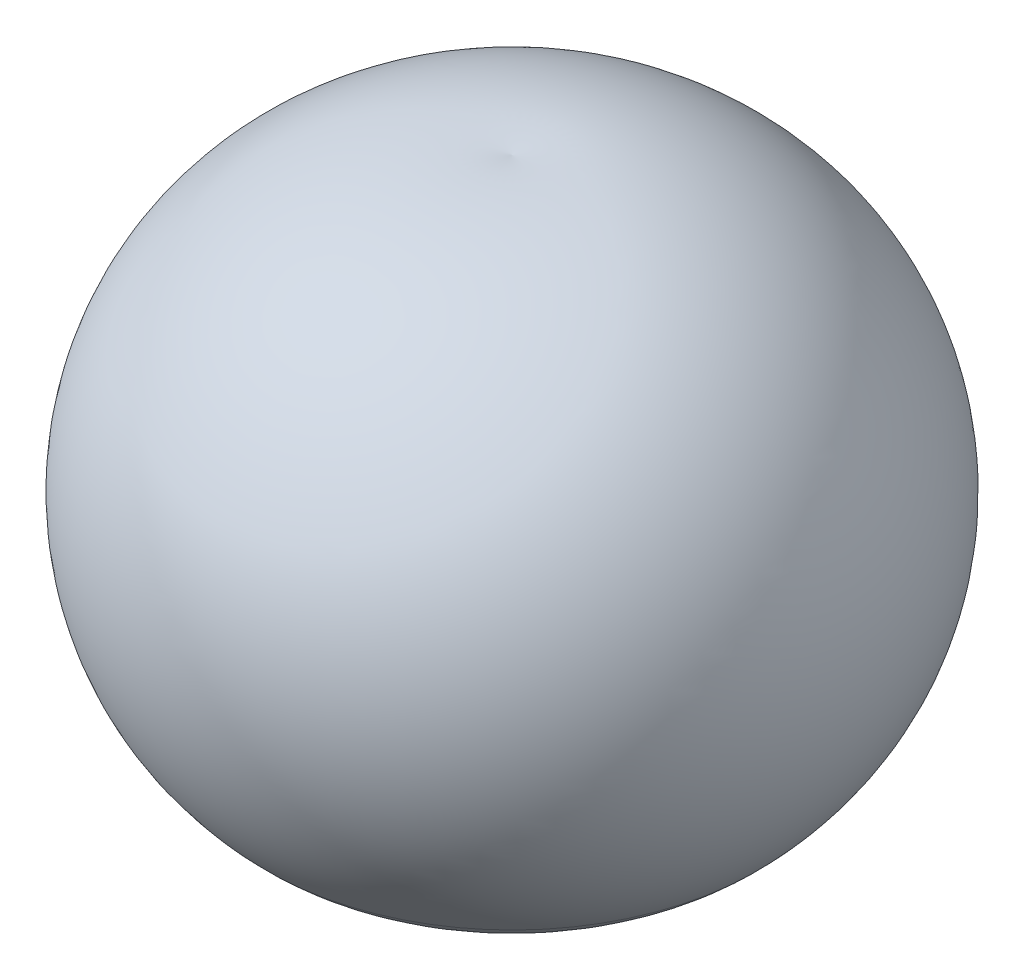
SolidWorks part; units mm, degrees
ref_plane "前视基准面" through (0, 0, 0) normal (0, 0, 1) x (1, 0, 0)
ref_plane "上视基准面" through (0, 0, 0) normal (0, 1, 0) x (1, 0, 0)
ref_plane "右视基准面" through (0, 0, 0) normal (1, 0, 0) x (0, 0, -1)
sketch "草图2" plane through (0, 0, 0) normal (1, 0, 0) x (0, 0, -1)
  line L0 (0, 0) -> (0, 550) construction
  line L1 (0, 550) -> (-230, 550) construction
  line L2 (-230, 550) -> (-230, 1400) construction
  line L3 (-230, 550) -> (-831.0408, -51.0408) construction
  line L4 (-831.0408, -51.0408) -> (-951.2489, -171.2489) construction
  line L5 (-951.2489, -171.2489) -> (-560.8515, -561.6464) construction
  line L6 (-831.0408, -51.0408) -> (-232.8284, -889.6694) construction
  line L7 (-831.0408, -51.0408) -> (98.7257, 392.457) construction
  line L8 (-230, 550) -> (620, 550) construction
  line L9 (620, 550) -> (790, 550) construction
  line L10 (790, 550) -> (790, 1566) construction
  line L11 (620, 550) -> (790, 1566) construction
  line L12 (620, 550) -> (362.0967, -447.3173) construction
  line L13 (0, -659.7503) -> (0, 267.192)
  line L14 (0, 1372.6518) -> (0, 2416.003)
  line L15 (0, -659.7503) -> (0, 2652.101) construction
  line L16 (55, 0) -> (-55, 0) construction
  arc A1 (0, 2416.003) -> (-1559.4486, -779.4486) centre (-230, 550) ccw
  arc A2 (-360.6482, 865.4126) -> (-387.543, 878.7257) centre (-831.0408, -51.0408) ccw construction
  arc A4 (-351.0445, 893.8439) -> (0, 267.192) centre (-230, 550) ccw
  arc A7 (-1559.4486, -779.4486) -> (0, -659.7503) centre (-831.0408, -51.0408) ccw
  arc A8 (0, 1372.6518) -> (-351.0445, 893.8439) centre (620, 550) ccw
  dimension "D3" = 850
  dimension "D4" = 850
  dimension "D5" = 135
  dimension "D6" = 170
  dimension "D7" = 1016
  dimension "D8" = 2110.1243
  dimension "D9" = 80
  dimension "D11" = 170
  dimension "D12" = 1016
  dimension "D13" = 185
revolve "旋转1" add sketch "草图2" angle 360 about L15
